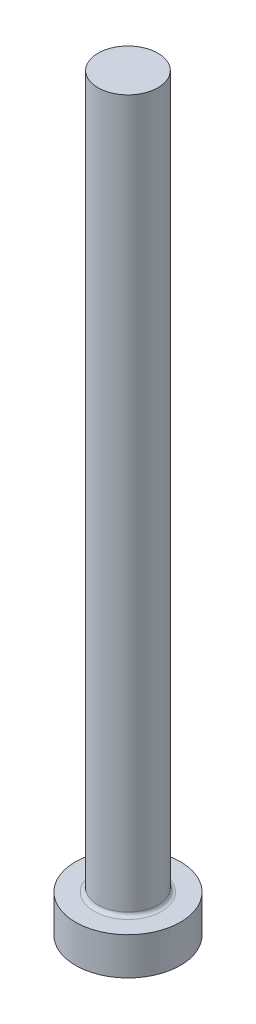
SolidWorks part; units mm, degrees
ref_plane "Plano frontal" through (0, 0, 0) normal (0, 0, 1) x (1, 0, 0)
ref_plane "Plano superior" through (0, 0, 0) normal (0, 1, 0) x (1, 0, 0)
ref_plane "Plano direito" through (0, 0, 0) normal (1, 0, 0) x (0, 0, -1)
sketch "Esboço1" plane through (0, 0, 0) normal (0, 0, 1) x (1, 0, 0)
  line L0 (0, 0) -> (7, 0)
  line L1 (7, 0) -> (7, 5)
  line L2 (7, 5) -> (4.5, 5)
  line L3 (4, 5.5) -> (4, 100)
  line L4 (4, 100) -> (0, 100)
  line L5 (0, 100) -> (0, 0) construction
  line L6 (0, 0) -> (0, 100)
  arc A0 (4.5, 5) -> (4, 5.5) centre (4.5, 5.5) cw
  dimension "D3" = 0.5
  dimension "D1" = 14
  dimension "D2" = 8
  dimension "D4" = 5
  dimension "D5" = 100
revolve "Revolução1" add sketch "Esboço1" angle 360 about L5
sketch "Esboço2"
  dimension "D1" = 0.525
  dimension "D2" = 1.225
  dimension "D3" = 0.7875
  dimension "D4" = 3.7625
wrap "Envolver1" sketch "Esboço2" wrap type deboss source sketch "Esboço2" thickness 0.1 parameters "D1"=0.1
